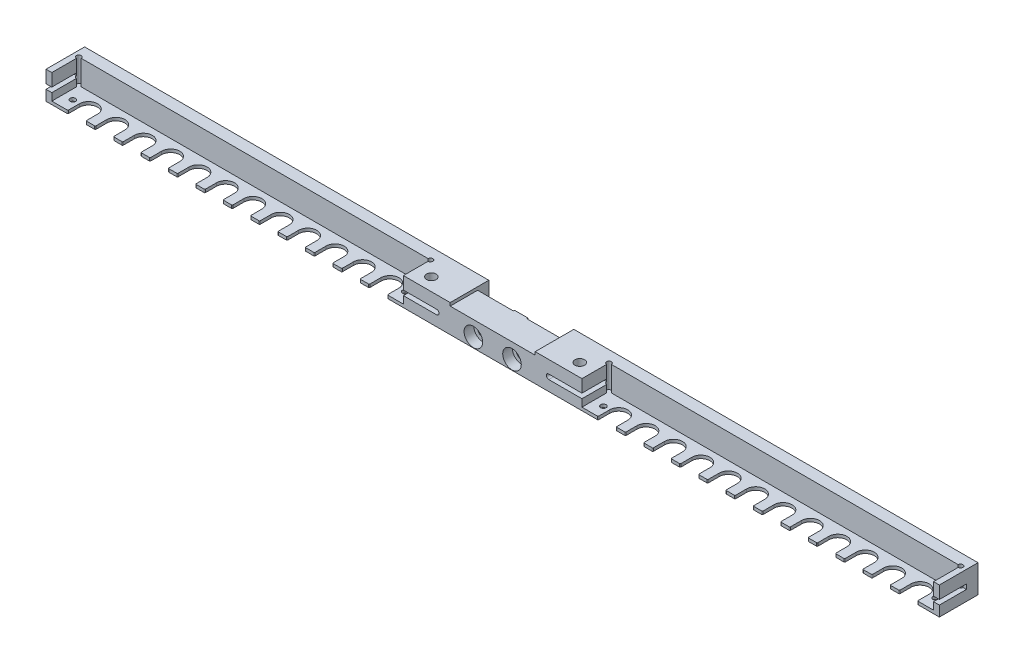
SolidWorks part; units mm, degrees
ref_plane "Front Plane" through (0, 0, 0) normal (0, 0, 1) x (1, 0, 0)
ref_plane "Top Plane" through (0, 0, 0) normal (0, 1, 0) x (1, 0, 0)
ref_plane "Right Plane" through (0, 0, 0) normal (1, 0, 0) x (0, 0, -1)
sketch "Sketch1" plane through (0, 0, 0) normal (0, 1, 0) x (1, 0, 0)
  line L1 (0, 0) -> (293.624, 0)
  line L2 (0, 0) -> (0, -12.7)
  line L3 (0, -12.7) -> (293.624, -12.7)
  line L4 (293.624, 0) -> (293.624, -12.7)
  dimension "D1" = 293.624
  dimension "D2" = 12.7
extrude "Extrude1" add sketch "Sketch1" against normal blind 9.144
sketch "Sketch2" plane through (0, 0, 0) normal (0, 1, 0) x (-1, 0, 0)
  line L0 (0, 12.7) -> (-293.624, 12.7) construction
  line L1 (-1.905, 12.7) -> (-117.475, 12.7)
  line L2 (-1.905, 12.7) -> (-1.905, 4.5974)
  line L3 (-2.6924, 3.81) -> (-116.6876, 3.81)
  line L4 (-117.475, 12.7) -> (-117.475, 4.5974)
  line L5 (0, 0) -> (0, 12.7) construction
  line L6 (-293.624, 0) -> (0, 0) construction
  arc A0 (-2.6924, 3.81) -> (-1.905, 4.5974) centre (-1.905, 3.81) ccw
  arc A1 (-117.475, 4.5974) -> (-116.6876, 3.81) centre (-117.475, 3.81) ccw
  dimension "D4" = 115.57
  dimension "D3" = 0.7874
  dimension "D1" = 1.905
  dimension "D2" = 3.81
extrude "Cut-Extrude1" cut sketch "Sketch2" against normal blind 8.128
sketch "Sketch3" plane through (0, -8.128, 0) normal (0, 1, 0) x (-1, 0, 0)
  line L0 (0, 0) -> (0, 12.7) construction
  line L1 (-7.1882, 8.89) -> (-7.1882, 12.7)
  line L2 (-1.905, 12.7) -> (-117.475, 12.7) construction
  line L3 (-13.1318, 8.89) -> (-13.1318, 12.7)
  line L4 (-13.1318, 12.7) -> (-7.1882, 12.7)
  arc A0 (-13.1318, 8.89) -> (-7.1882, 8.89) centre (-10.16, 8.89) ccw
  dimension "D2" = 3.81
  dimension "D3" = 2.9718
  dimension "D1" = 10.16
extrude "Cut-Extrude2" cut sketch "Sketch3" against normal through all
pattern_linear "LPattern1" count 12 spacing 9.0043 along (1, 0, 0) of "Cut-Extrude2"
sketch "Sketch4" plane through (0, -8.128, 0) normal (0, 1, 0) x (-1, 0, 0)
  line L0 (0, 0) -> (0, 12.7) construction
  line L1 (-1.905, 12.7) -> (-7.1882, 12.7) construction
  circle A0 centre (-5.0038, 8.89) radius 0.889
  dimension "D1" = 5.0038
  dimension "D2" = 3.81
extrude "Cut-Extrude3" cut sketch "Sketch4" against normal through all
pattern_linear "LPattern2" count 2 spacing 109.22 along (1, 0, 0) of "Cut-Extrude3"
ref_plane "Plane1" through (146.812, 0, 0) normal (1, 0, 0) x (0, 0, -1)
mirror "Mirror2" about plane through (146.812, 0, 0) normal (1, 0, 0) of "LPattern2", "Cut-Extrude3", "LPattern1", "Cut-Extrude2", "Cut-Extrude1"
sketch "Sketch5" plane through (0, 0, 0) normal (0, 1, 0) x (-1, 0, 0)
  line L0 (-293.624, 0) -> (0, 0) construction
  line L1 (-132.842, 0) -> (-160.782, 0)
  line L2 (-132.842, 0) -> (-132.842, 12.7)
  line L3 (-132.842, 12.7) -> (-160.782, 12.7)
  line L4 (-160.782, 0) -> (-160.782, 12.7)
  line L5 (-117.475, 12.7) -> (-176.149, 12.7) construction
  line L6 (-146.812, 5.0292) -> (-146.812, -5.0292) construction
  dimension "D1" = 13.97
  dimension "D2" = 13.97
extrude "Cut-Extrude4" cut sketch "Sketch5" against normal blind 1.016
sketch "Sketch6" plane through (0, 0, 0) normal (0, 0, -1) x (-1, 0, 0)
  line L0 (-293.624, -9.144) -> (0, -9.144) construction
  line L1 (-160.782, 0) -> (-132.842, 0)
  line L2 (-160.782, 0) -> (-160.782, -9.144)
  line L3 (-160.782, -9.144) -> (-132.842, -9.144)
  line L4 (-132.842, 0) -> (-132.842, -9.144)
  line L6 (-146.812, 5.0292) -> (-146.812, -5.0292) construction
  dimension "D1" = 13.97
extrude "Cut-Extrude5" cut sketch "Sketch6" against normal blind 3.302
sketch "Sketch7" plane through (0, 0, 3.302) normal (0, 0, -1) x (-1, 0, 0)
  line L0 (-160.782, -9.144) -> (-132.842, -9.144) construction
  line L1 (-160.782, -1.016) -> (-149.0345, -1.016)
  line L2 (-160.782, -1.016) -> (-160.782, -9.144)
  line L3 (-160.782, -9.144) -> (-149.0345, -9.144)
  line L4 (-149.0345, -1.016) -> (-149.0345, -9.144)
  dimension "D1" = 11.7475
extrude "Cut-Extrude6" cut sketch "Sketch7" against normal blind 0.381
mirror "Mirror3" about plane through (146.812, 0, 0) normal (1, 0, 0) of "Cut-Extrude6"
hole_wizard "CBORE for #4 Binding Head Machine Screw1" positions "Sketch9" profile "Sketch8" counterbore size "#4" standard "Ansi Inch"
sketch "Sketch9" plane through (0, 0, 12.7) normal (0, 0, 1) x (1, 0, 0)
  line L0 (146.812, -5.0292) -> (146.812, 5.0292) construction
  line L1 (112.1791, -9.144) -> (181.4449, -9.144) construction
  point P0 (153.162, -5.969)
  dimension "D1" = 6.35
  dimension "D2" = 3.175
sketch "Sketch8" plane through (153.162, -5.969, 12.7) normal (1, 0, 0) x (0, -1, 0)
  line L0 (0, 0) -> (0, 12.7)
  line L1 (0, 12.7) -> (1.778, 12.7)
  line L3 (1.778, 12.7) -> (1.778, 3.175)
  line L4 (1.778, 3.175) -> (3.048, 3.175)
  line L5 (3.048, 3.175) -> (3.048, 0)
  line L7 (3.048, 0) -> (0, 0)
  line L11 (0, -6.35) -> (0, 107.95) construction
  dimension "Thru Hole Dia." = 3.556
  dimension "Thru Hole Depth" = 12.7
  dimension "C'Bore Dia." = 6.096
  dimension "C'Bore Depth" = 3.175
mirror "Mirror4" about plane through (146.812, 0, 0) normal (1, 0, 0) of "CBORE for #4 Binding Head Machine Screw1"
sketch "Sketch10" plane through (0, 0, 12.7) normal (0, 0, 1) x (1, 0, 0)
  line L0 (0, -9.144) -> (0, 0) construction
  line L1 (0, -4.1402) -> (128.397, -4.1402)
  line L2 (0, -4.1402) -> (0, -5.715)
  line L3 (0, -5.715) -> (128.397, -5.715)
  line L5 (1.905, -8.128) -> (7.1882, -8.128) construction
  arc A0 (128.397, -4.1402) -> (128.397, -5.715) centre (128.397, -4.9276) cw
  dimension "D1" = 1.5748
  dimension "D2" = 2.413
extrude "Cut-Extrude7" cut sketch "Sketch10" against normal blind 8.89
sketch "Sketch11" plane through (0, 0, 0) normal (0, 1, 0) x (-1, 0, 0)
  line L0 (-146.812, 5.0292) -> (-146.812, -5.0292) construction
  line L1 (-128.397, 12.7) -> (-117.475, 12.7) construction
  circle A0 centre (-122.428, 8.4582) radius 1.5875
  point P4 (-122.936, 12.7)
  dimension "D1" = 24.384
  dimension "D2" = 4.2418
extrude "Cut-Extrude8" cut sketch "Sketch11" against normal through all
mirror "Mirror5" about plane through (146.812, 0, 0) normal (1, 0, 0) of "Cut-Extrude8", "Cut-Extrude7"
fillet "Fillet2" radius 0.254 24 edges at (58.1533, -8.636, 12.7) (52.2097, -8.636, 12.7) (67.1576, -8.636, 12.7) (61.214, -8.636, 12.7) (76.1619, -8.636, 12.7) (70.2183, -8.636, 12.7) (85.1662, -8.636, 12.7) (79.2226, -8.636, 12.7) (94.1705, -8.636, 12.7) (88.2269, -8.636, 12.7) (103.1748, -8.636, 12.7) (97.2312, -8.636, 12.7) (112.1791, -8.636, 12.7) (106.2355, -8.636, 12.7) (13.1318, -8.636, 12.7) (7.1882, -8.636, 12.7) (22.1361, -8.636, 12.7) (16.1925, -8.636, 12.7) (31.1404, -8.636, 12.7) (25.1968, -8.636, 12.7) (40.1447, -8.636, 12.7) (34.2011, -8.636, 12.7) (49.149, -8.636, 12.7) (43.2054, -8.636, 12.7)
fillet "Fillet3" radius 0.254 24 edges at (286.4358, -8.636, 12.7) (280.4922, -8.636, 12.7) (277.4315, -8.636, 12.7) (271.4879, -8.636, 12.7) (268.4272, -8.636, 12.7) (262.4836, -8.636, 12.7) (259.4229, -8.636, 12.7) (253.4793, -8.636, 12.7) (250.4186, -8.636, 12.7) (244.475, -8.636, 12.7) (241.4143, -8.636, 12.7) (235.4707, -8.636, 12.7) (232.41, -8.636, 12.7) (226.4664, -8.636, 12.7) (223.4057, -8.636, 12.7) (217.4621, -8.636, 12.7) (214.4014, -8.636, 12.7) (208.4578, -8.636, 12.7) (205.3971, -8.636, 12.7) (199.4535, -8.636, 12.7) (196.3928, -8.636, 12.7) (190.4492, -8.636, 12.7) (187.3885, -8.636, 12.7) (181.4449, -8.636, 12.7)
